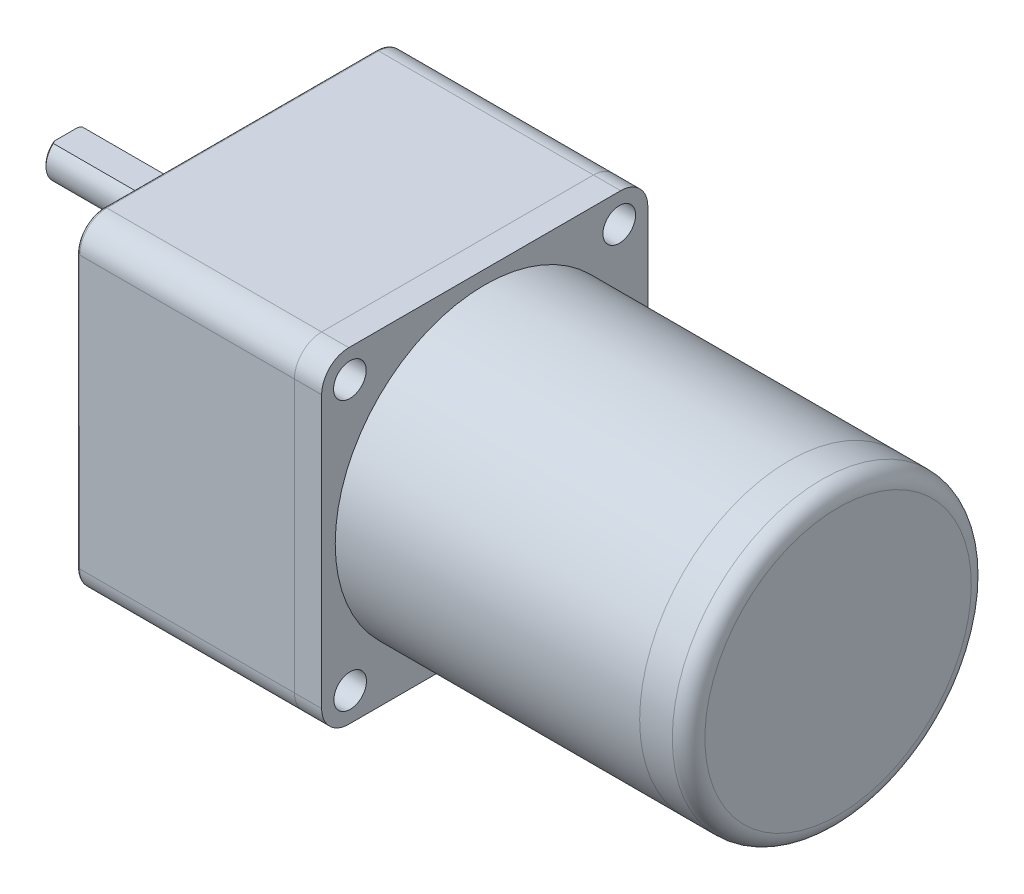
SolidWorks part; units mm, degrees
ref_plane "前视基准面" through (0, 0, 0) normal (0, 0, 1) x (1, 0, 0)
ref_plane "上视基准面" through (0, 0, 0) normal (0, 1, 0) x (1, 0, 0)
ref_plane "右视基准面" through (0, 0, 0) normal (1, 0, 0) x (0, 0, -1)
sketch "草图1" plane through (0, 0, 0) normal (1, 0, 0) x (0, 0, -1)
  line L1 (-25, -30) -> (25, -30)
  line L2 (-30, -25) -> (-30, 25)
  line L3 (-25, 30) -> (25, 30)
  line L4 (30, -25) -> (30, 25)
  line L5 (-30, -30) -> (30, 30) construction
  line L6 (-30, 30) -> (30, -30) construction
  arc A0 (-25, -30) -> (-30, -25) centre (-25, -25) cw
  arc A1 (25, -30) -> (30, -25) centre (25, -25) ccw
  arc A2 (25, 30) -> (30, 25) centre (25, 25) cw
  arc A3 (-30, 25) -> (-25, 30) centre (-25, 25) cw
  point P0 (0, 0)
  dimension "D1" = 5
extrude "凸台-拉伸1" add sketch "草图1" along normal blind 40
sketch "草图2" plane through (40, 0, 0) normal (1, 0, 0) x (0, 0, -1)
  line L0 (25, 30) -> (-25, 30) construction
  line L1 (-25, -30) -> (25, -30)
  line L2 (-30, -25) -> (-30, 25)
  line L3 (-25, 30) -> (25, 30)
  line L4 (30, -25) -> (30, 25)
  line L5 (-30, -30) -> (30, 30) construction
  line L6 (-30, 30) -> (30, -30) construction
  arc A0 (25, 30) -> (30, 25) centre (25, 25) cw
  arc A1 (25, -30) -> (30, -25) centre (25, -25) ccw
  arc A2 (-25, -30) -> (-30, -25) centre (-25, -25) cw
  arc A3 (-30, 25) -> (-25, 30) centre (-25, 25) cw
  point P0 (0, 0)
  dimension "D1" = 5
extrude "凸台-拉伸2" add sketch "草图2" along normal blind 5 separate body
sketch "草图3" plane through (45, 0, 0) normal (1, 0, 0) x (0, 0, -1)
  circle A0 centre (0, 0) radius 27.5
extrude "凸台-拉伸3" add sketch "草图3" along normal blind 56 separate body
sketch "草图4" plane through (101, 0, 0) normal (1, 0, 0) x (0, 0, -1)
  circle A0 centre (0, 0) radius 27.5
extrude "凸台-拉伸4" add sketch "草图4" along normal blind 9 separate body
fillet "圆角1" radius 3 1 edges at (110, 0, -27.5)
sketch "草图5" plane through (0, 0, 0) normal (-1, 0, 0) x (0, 0, 1)
  circle A0 centre (0, 10) radius 12
extrude "凸台-拉伸5" add sketch "草图5" along normal blind 3 separate body
sketch "草图6" plane through (-3, 0, 0) normal (-1, 0, 0) x (0, 0, 1)
  circle A0 centre (0, 10) radius 4
extrude "凸台-拉伸6" add sketch "草图6" along normal blind 29 separate body
fillet "圆角2" radius 0.5 1 edges at (-3, 10, 12)
sketch "草图7" plane through (-32, 0, 0) normal (-1, 0, 0) x (0, 0, 1)
  line L2 (2.6458, 13) -> (-2.6458, 13)
  arc A0 (2.6458, 13) -> (-2.6458, 13) centre (0, 10) ccw
extrude "切除-拉伸1" cut sketch "草图7" against normal blind 25
chamfer "倒角1" distance 0.3 angle 45 1 edges at (-32, 6, 0)
sketch "草图8" plane through (0, 0, 0) normal (-1, 0, 0) x (0, 0, 1)
  circle A0 centre (0, 0) radius 26.3
extrude "切除-拉伸2" cut sketch "草图8" against normal blind 0.5
fillet "圆角3" radius 0.5 1 edges at (0, 0, 26.3)
fillet "圆角4" radius 0.5 8 edges at (0, -30, 0) (0, -28.5355, -28.5355) (0, 0, -30) (0, 28.5355, -28.5355) (0, 30, 0) (0, 28.5355, 28.5355) (0, 0, 30) (0, -28.5355, 28.5355)
sketch "草图9" plane through (0, 0, 0) normal (-1, 0, 0) x (0, 0, 1)
  point P19 (-24.7487, 24.7487)
  point P20 (24.7487, 24.7487)
  point P21 (24.7487, -24.7487)
  point P22 (-24.7487, -24.7487)
hole_wizard "M4 螺纹孔1" positions "3D草图1" profile "草图10" tap size "M4" standard "GB"
sketch3d "3D草图1"
  point P0 (0, 24.7487, -24.7487)
  point P3 (0, 24.7487, 24.7487)
  point P6 (0, -24.7487, 24.7487)
  point P9 (0, -24.7487, -24.7487)
sketch "草图10" plane through (0, 24.7487, -24.7487) normal (0, 1, 0) x (0, 0, 1)
  line L0 (0, 0) -> (0, 12.9914)
  line L1 (0, 12.9914) -> (1.65, 12)
  line L2 (1.65, 12) -> (1.65, 0)
  line L5 (1.65, 0) -> (0, 0)
  line L10 (0, 12.9914) -> (-1.65, 12) construction
  line L11 (0, -6.35) -> (0, 107.95) construction
  dimension "螺纹孔钻头直径" = 3.3
  dimension "螺纹孔钻头深度" = 12
  dimension "导头角度" = 118
sketch "草图11" plane through (45, 0, 0) normal (1, 0, 0) x (0, 0, -1)
  circle A5 centre (-24.8007, 24.8007) radius 3
  circle A6 centre (24.7487, 24.7487) radius 3
  circle A7 centre (24.7487, -24.7487) radius 3
  circle A8 centre (-24.7487, -24.7487) radius 3
extrude "切除-拉伸3" cut sketch "草图11" against normal blind 33
